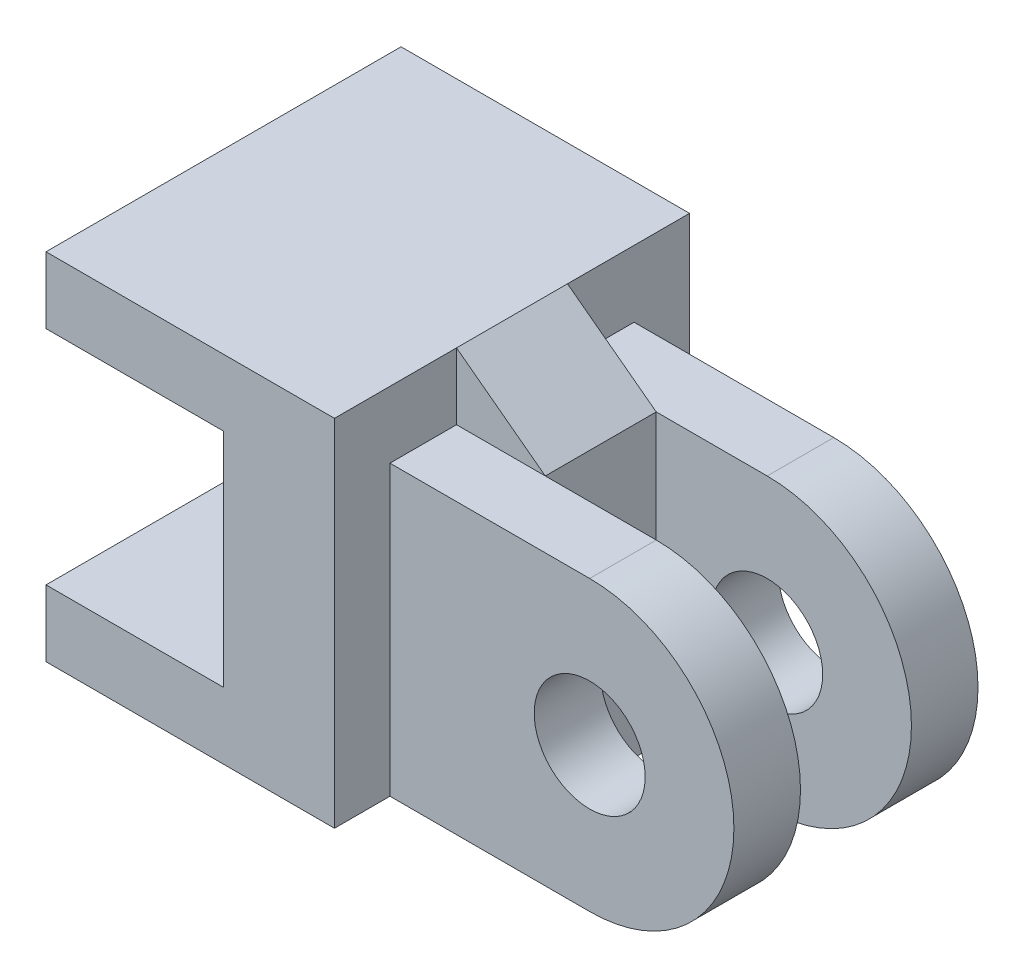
SolidWorks part; units mm, degrees
ref_plane "Front Plane" through (0, 0, 0) normal (0, 0, 1) x (1, 0, 0)
ref_plane "Top Plane" through (0, 0, 0) normal (0, 1, 0) x (1, 0, 0)
ref_plane "Right Plane" through (0, 0, 0) normal (1, 0, 0) x (0, 0, -1)
sketch "Sketch1" plane through (0, 0, 0) normal (0, 0, 1) x (1, 0, 0)
  line L0 (0, 0) -> (-40, 0) construction
  line L1 (0, -25) -> (0, 25)
  line L2 (0, 25) -> (-40, 25)
  line L3 (-40, 25) -> (-40, 40)
  line L4 (-40, 40) -> (25, 40)
  line L5 (25, 40) -> (25, -40)
  line L6 (-40, -40) -> (25, -40)
  line L7 (-40, -25) -> (-40, -40)
  line L8 (0, -25) -> (-40, -25)
  point P9 (25, 0)
  dimension "D1" = 40
  dimension "D2" = 65
  dimension "D3" = 80
  dimension "D4" = 15
extrude "Extrude1" add sketch "Sketch1" along normal mid plane 80
sketch "Sketch2" plane through (0, 0, 0) normal (0, 0, 1) x (1, 0, 0)
  line L0 (25, 40) -> (45, 25)
  line L1 (45, 25) -> (45, -40)
  line L2 (45, -40) -> (25, -40)
  line L3 (25, -40) -> (25, 40)
  dimension "D1" = 20
  dimension "D2" = 65
extrude "Extrude2" add sketch "Sketch2" along normal mid plane 25
sketch "Sketch3" plane through (0, 0, 12.5) normal (0, 0, 1) x (1, 0, 0)
  line L0 (25, -40) -> (70, -40)
  line L1 (70, 25) -> (25, 25)
  line L2 (25, 40) -> (25, -40) construction
  line L3 (25, 25) -> (25, -40)
  arc A0 (70, -40) -> (70, 25) centre (70, -7.5) ccw
  circle A1 centre (70, -7.5) radius 12.5
  dimension "D1" = 45
  dimension "D2" = 25
extrude "Extrude3" add sketch "Sketch3" along normal blind 15
mirror "Mirror1" about plane through (0, 0, 0) normal (0, 0, 1)
